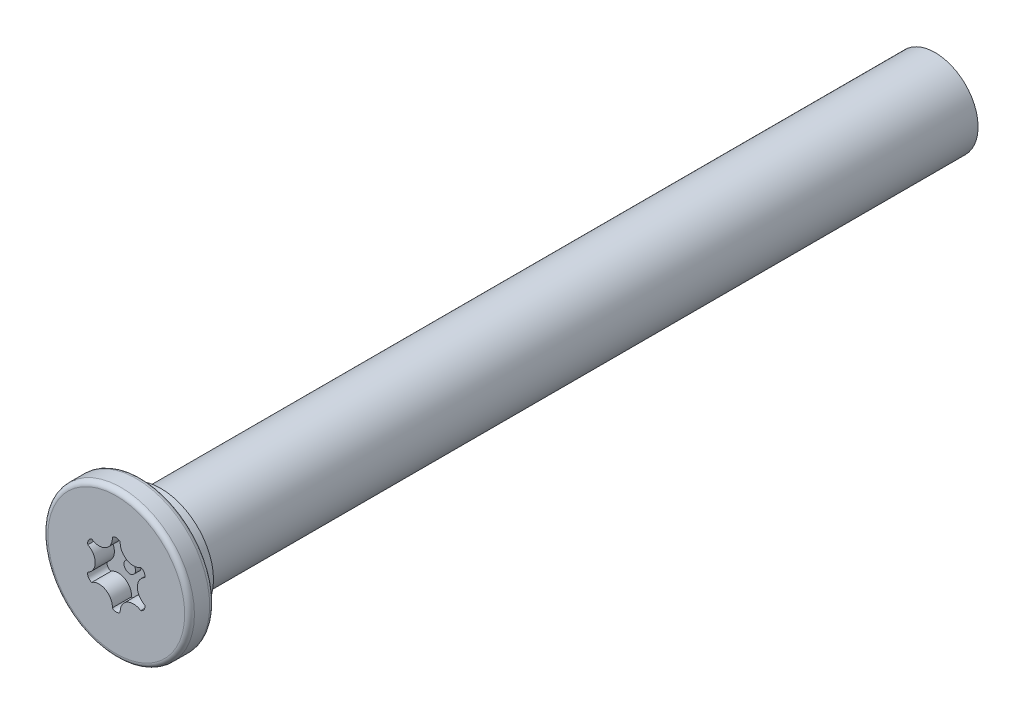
SolidWorks part; units mm, degrees
ref_plane "Front Plane" through (0, 0, 0) normal (0, 0, 1) x (1, 0, 0)
ref_plane "Top Plane" through (0, 0, 0) normal (0, 1, 0) x (1, 0, 0)
ref_plane "Right Plane" through (0, 0, 0) normal (1, 0, 0) x (0, 0, -1)
sketch "Sketch2" plane through (0, 0, 0) normal (1, 0, 0) x (0, 0, -1)
  line L1 (0, 0) -> (1.3, 0)
  line L2 (0, 0) -> (0, 3.81)
  line L3 (0, 3.81) -> (1.3, 3.81)
  line L4 (1.3, 0) -> (1.3, 3.81)
  line L5 (1.3, 0) -> (14, 0)
  line L6 (1.3, 0) -> (1.3, 2.23)
  line L7 (1.3, 2.23) -> (14, 2.23)
  line L8 (14, 0) -> (14, 2.23)
  dimension "D1" = 3.81
  dimension "D2" = 1.3
  dimension "D3" = 12.7
  dimension "D4" = 2.23
revolve "Revolve1" add sketch "Sketch2" angle 360 about L5
sketch "Sketch3" plane through (0, 0, 0) normal (0, 0, 1) x (1, 0, 0)
  line L0 (0, 1.3843) -> (0, 0)
  line L3 (1.1845, -1.0048) -> (2.4257, -1.0048)
  line L4 (0, 1.675) -> (0, 1.6727)
  line L5 (0, 1.675) -> (0, 1.6727)
  line L6 (0, 1.6727) -> (0, 1.675)
  line L8 (1.0407, 1.8026) -> (1.1012, 1.9073)
  line L9 (1.3857, 1.205) -> (2.5818, 1.205)
  line L10 (0, 0) -> (0.8375, 1.4506)
  line L11 (0, 0) -> (2.5818, 0)
  line L14 (2.5818, 0) -> (2.5818, 1.205)
  line L15 (1.3857, 1.205) -> (-0.1691, 1.205)
  circle A0 centre (0, 0) radius 1.675
  arc A7 (1.1845, -1.0048) -> (1.0345, -1.0748) centre (0.8546, -0.4934) cw
  arc A16 (-0.2051, 1.5894) -> (0.2051, 1.5894) centre (0, 1.3843) cw
  arc A18 (0.2051, 1.5894) -> (1.2739, 0.9723) centre (0.8938, 1.5482) ccw
  arc A19 (1.479, 0.6171) -> (1.479, -0.6171) centre (1.7877, 0) ccw
  arc A20 (1.2739, 0.9723) -> (1.479, 0.6171) centre (1.1988, 0.6922) cw
  arc A21 (1.2739, -0.9723) -> (0.2051, -1.5894) centre (0.8938, -1.5482) ccw
  arc A22 (1.479, -0.6171) -> (1.2739, -0.9723) centre (1.1988, -0.6922) cw
  arc A23 (-0.2051, -1.5894) -> (-1.2739, -0.9723) centre (-0.8938, -1.5482) ccw
  arc A24 (0.2051, -1.5894) -> (-0.2051, -1.5894) centre (0, -1.3843) cw
  arc A25 (-1.479, -0.6171) -> (-1.479, 0.6171) centre (-1.7877, 0) ccw
  arc A26 (-1.2739, -0.9723) -> (-1.479, -0.6171) centre (-1.1988, -0.6922) cw
  arc A27 (-1.2739, 0.9723) -> (-0.2051, 1.5894) centre (-0.8938, 1.5482) ccw
  arc A28 (-1.479, 0.6171) -> (-1.2739, 0.9723) centre (-1.1988, 0.6922) cw
  point P38 (0, 0)
  point P52 (0, 0)
  dimension "D1" = 3.35
  dimension "D4" = 1.205
  dimension "D2" = 6
  dimension "D5" = 60
extrude "Cut-Extrude3" cut sketch "Sketch3" against normal blind 1
fillet "Fillet12" radius 0.254 2 edges at (3.81, 0, 0) (3.81, 0, -1.3)
sketch "Sketch7" plane through (0, 0, -14) normal (0, 0, -1) x (-1, 0, 0)
  circle A0 centre (0, 0) radius 2.23
  dimension "D1" = 4.46
extrude "Cut-Extrude6" cut sketch "Sketch7" against normal blind 12.7
sketch "Sketch11" plane through (0, 0, -1.3) normal (0, 0, -1) x (-1, 0, 0)
  circle A0 centre (0, 0) radius 2.23
  circle A1 centre (0, 0) radius 2.738
extrude "Boss-Extrude1" add sketch "Sketch11" along normal blind 1.016
sketch "Sketch12" plane through (0, 0, -1.3) normal (0, 0, -1) x (-1, 0, 0)
  circle A0 centre (0, 0) radius 2.23
extrude "Boss-Extrude2" add sketch "Sketch12" along normal blind 12.7
sketch "Sketch14" plane through (0, 0, -1) normal (0, 0, 1) x (1, 0, 0)
  circle A0 centre (0, 0) radius 0.3
extrude "Boss-Extrude4" add sketch "Sketch14" along normal blind 0.3
sketch "Sketch15" plane through (0, 0, -14) normal (0, 0, -1) x (-1, 0, 0)
  circle A0 centre (0, 0) radius 2.23
extrude "Cut-Extrude7" cut sketch "Sketch15" against normal blind 12.7
sketch "Sketch16" plane through (0, 0, -1.3) normal (0, 0, -1) x (-1, 0, 0)
  circle A0 centre (0, 0) radius 2.23
extrude "Boss-Extrude5" add sketch "Sketch16" along normal blind 41.275 contours A0
